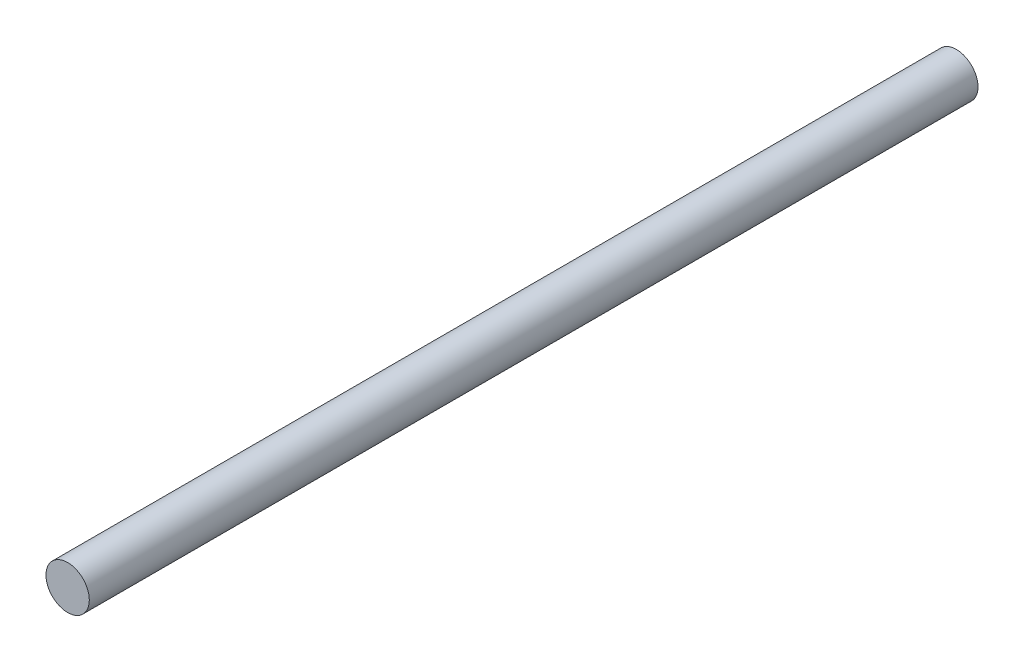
SolidWorks part; units mm, degrees
ref_plane "Face" through (0, 0, 0) normal (0, 0, 1) x (1, 0, 0)
ref_plane "Dessus" through (0, 0, 0) normal (0, 1, 0) x (1, 0, 0)
ref_plane "Droite" through (0, 0, 0) normal (1, 0, 0) x (0, 0, -1)
sketch "Esquisse1" plane through (0, 0, 0) normal (0, 0, 1) x (1, 0, 0)
  circle A0 centre (0, 0) radius 1
  dimension "D1" = 2
extrude "Extrusion1" add sketch "Esquisse1" along normal blind 41
